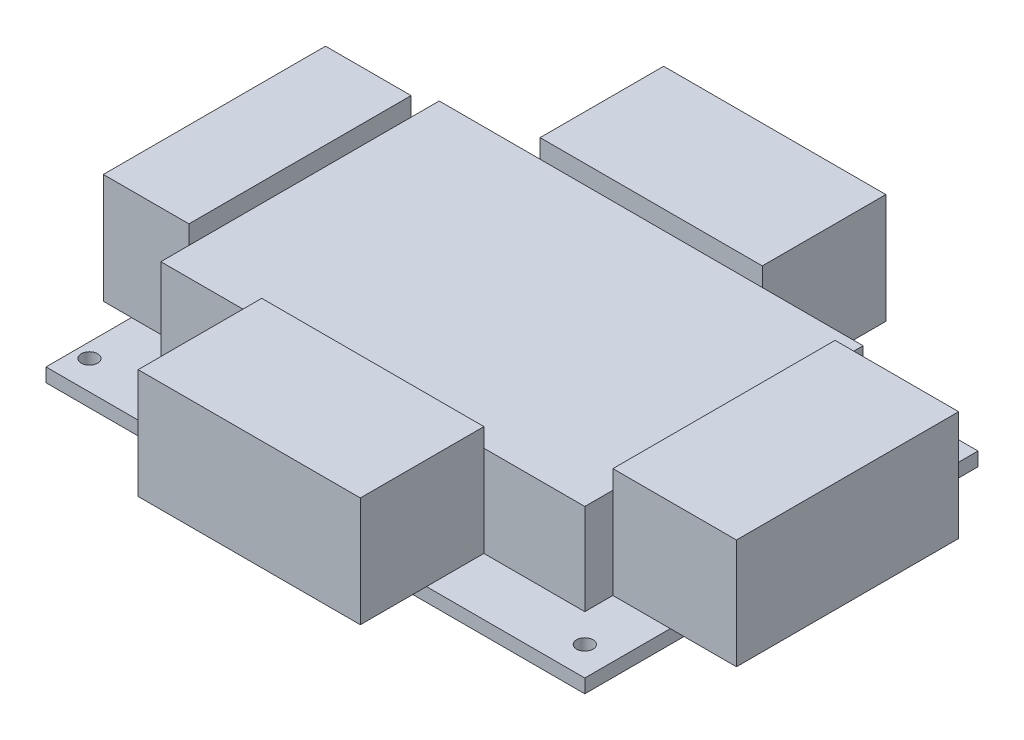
SolidWorks part; units mm, degrees
ref_plane "Front Plane" through (0, 0, 0) normal (0, 0, 1) x (1, 0, 0)
ref_plane "Top Plane" through (0, 0, 0) normal (0, 1, 0) x (1, 0, 0)
ref_plane "Right Plane" through (0, 0, 0) normal (1, 0, 0) x (0, 0, -1)
sketch "Sketch1" plane through (0, 0, 0) normal (0, 1, 0) x (1, 0, 0)
  line L0 (109.6391, 5.9119) -> (103.7272, 5.9119) construction
  line L1 (0, 0) -> (109.6391, 0)
  line L2 (0, 0) -> (0, 80.01)
  line L3 (0, 80.01) -> (109.6391, 80.01)
  line L4 (109.6391, 0) -> (109.6391, 80.01)
  line L5 (103.7272, 5.9119) -> (103.7272, 0) construction
  line L6 (103.7272, 5.9119) -> (2.9274, 5.9119) construction
  line L7 (2.9274, 5.9119) -> (2.9274, 0) construction
  line L8 (2.9274, 5.9119) -> (2.9274, 74.0982) construction
  line L9 (2.9274, 74.0982) -> (103.7272, 74.0982) construction
  line L10 (103.7272, 74.0982) -> (103.7272, 5.9119) construction
  line L11 (103.7272, 74.0982) -> (103.7272, 80.01) construction
  line L12 (1.2573, 5.9119) -> (1.2573, 12.2927) construction
  line L13 (1.2573, 12.2927) -> (105.3973, 12.2927) construction
  line L14 (105.3973, 12.2927) -> (105.3973, 5.9119) construction
  line L15 (103.7272, 75.7682) -> (98.6874, 75.7682) construction
  line L16 (98.6874, 75.7682) -> (98.6874, 4.2418) construction
  line L17 (98.6874, 4.2418) -> (103.7272, 4.2418) construction
  circle A0 centre (103.7272, 5.9119) radius 1.6701
  circle A1 centre (103.7272, 74.0982) radius 1.6701
  circle A2 centre (2.9274, 74.0982) radius 1.67
  circle A3 centre (2.9274, 5.9119) radius 1.6701
  point P17 (103.7272, 75.7682)
  point P18 (1.2573, 5.9119)
  dimension "D4" = 3.3401
  dimension "D1" = 109.6391
  dimension "D2" = 80.01
  dimension "D3" = 71.5264
  dimension "D5" = 104.14
extrude "Boss-Extrude1" add sketch "Sketch1" along normal blind 2.794
sketch "Sketch2" plane through (0, 2.794, 0) normal (0, 1, 0) x (1, 0, 0)
  line L0 (109.6391, 0) -> (109.6391, 80.01) construction
  line L1 (11.684, 11.684) -> (97.9551, 11.684)
  line L2 (11.684, 11.684) -> (11.684, 68.326)
  line L3 (11.684, 68.326) -> (97.9551, 68.326)
  line L4 (97.9551, 11.684) -> (97.9551, 68.326)
  line L5 (109.6391, 68.326) -> (97.9551, 68.326) construction
  line L6 (97.9551, 68.326) -> (97.9551, 80.01) construction
  line L7 (109.6391, 80.01) -> (0, 80.01) construction
  line L8 (11.684, 0) -> (11.684, 11.684) construction
  line L9 (0, 0) -> (109.6391, 0) construction
  line L10 (11.684, 11.684) -> (0, 11.684) construction
  line L11 (0, 80.01) -> (0, 0) construction
  dimension "D1" = 11.684
extrude "Boss-Extrude2" add sketch "Sketch2" along normal blind 18.542
ref_plane "Plane1" through (0, 0, -40.005) normal (0, 0, -1) x (-1, 0, 0)
sketch "Sketch3" plane through (0, 2.794, 0) normal (0, 1, 0) x (1, 0, 0)
  line L0 (97.9551, 11.684) -> (97.9551, 68.326) construction
  line L1 (123.1011, 62.611) -> (97.9551, 62.611)
  line L2 (123.1011, 62.611) -> (123.1011, 17.399)
  line L3 (123.1011, 17.399) -> (97.9551, 17.399)
  line L4 (97.9551, 62.611) -> (97.9551, 17.399)
  line L5 (11.684, 11.684) -> (97.9551, 11.684) construction
  line L6 (77.4256, 11.684) -> (32.2135, 11.684)
  line L7 (77.4256, 11.684) -> (77.4256, -13.462)
  line L8 (77.4256, -13.462) -> (32.2135, -13.462)
  line L9 (32.2135, 11.684) -> (32.2135, -13.462)
  line L10 (11.684, 68.326) -> (11.684, 11.684) construction
  line L11 (11.684, 17.399) -> (-5.7301, 17.399)
  line L12 (11.684, 17.399) -> (11.684, 62.611)
  line L13 (11.684, 62.611) -> (-5.7301, 62.611)
  line L14 (-5.7301, 17.399) -> (-5.7301, 62.611)
  line L15 (97.9551, 68.326) -> (11.684, 68.326) construction
  line L16 (32.2135, 68.326) -> (77.4256, 68.326)
  line L17 (32.2135, 68.326) -> (32.2135, 93.472)
  line L18 (32.2135, 93.472) -> (77.4256, 93.472)
  line L19 (77.4256, 68.326) -> (77.4256, 93.472)
  line L20 (10.1981, 40.005) -> (-10.1981, 40.005) construction
  line L21 (109.6391, 80.01) -> (0, 80.01) construction
  line L22 (109.6391, 0) -> (109.6391, 80.01) construction
  point P26 (54.8195, 93.472)
  point P29 (54.8195, 80.01)
  point P30 (97.9551, 40.005)
  point P31 (84.582, 100.3791)
  point P32 (118.3513, 20.8438)
  point P33 (76.7926, 91.5104)
  point P34 (118.3513, 56.3459)
  point P35 (118.3513, 57.4959)
  point P36 (118.3513, 23.3331)
  dimension "D1" = 45.212
  dimension "D2" = 13.462
extrude "Boss-Extrude3" add sketch "Sketch3" along normal blind 22.352
